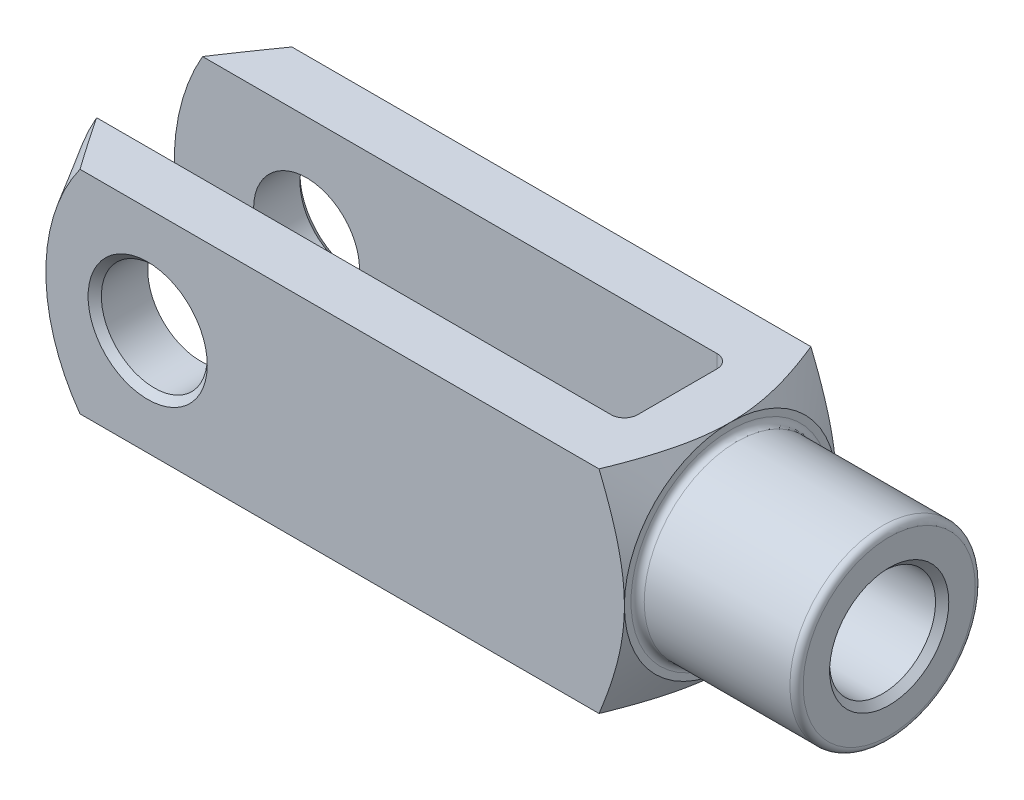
SolidWorks part; units mm, degrees
ref_plane "Front Plane" through (0, 0, 0) normal (0, 0, 1) x (1, 0, 0)
ref_plane "Top Plane" through (0, 0, 0) normal (0, 1, 0) x (1, 0, 0)
ref_plane "Right Plane" through (0, 0, 0) normal (1, 0, 0) x (0, 0, -1)
sketch "Sketch1" plane through (0, 0, 0) normal (1, 0, 0) x (0, 0, -1)
  line L0 (0, 0) -> (0, 50000) construction
  line L1 (0, 0) -> (50000, 0) construction
  line L2 (-8, -8) -> (-8, 8)
  line L3 (-8, 8) -> (8, 8)
  line L4 (8, -8) -> (8, 8)
  line L5 (-8, -8) -> (8, -8)
  point P9 (0, 8)
  point P11 (8, 0)
  point P12 (-8, 0)
  dimension "D1" = 16
  dimension "D2" = 16
extrude "Extrude1" add sketch "Sketch1" against normal blind 58
sketch "Sketch2" plane through (0, 0, 0) normal (1, 0, 0) x (0, 0, -1)
  circle A0 centre (0, 0) radius 7
  circle A1 centre (0, 0) radius 14
  dimension "D1" = 14
  dimension "D2" = 28
extrude "Extrude2" cut sketch "Sketch2" against normal blind 12
sketch "Sketch3" plane through (0, 0, 8) normal (0, 0, 1) x (1, 0, 0)
  circle A0 centre (-48, 0) radius 4
  dimension "D1" = 8
  dimension "D2" = 48
extrude "Extrude3" cut sketch "Sketch3" against normal through all
sketch "Sketch4" plane through (0, 8, 0) normal (0, 1, 0) x (1, 0, 0)
  line L0 (0, 0) -> (-50000, 0) construction
  line L1 (-58, -4) -> (-58, 4)
  line L2 (-58, 8) -> (-58, -8) construction
  line L3 (-58, 4) -> (-16, 4)
  line L4 (-16, 4) -> (-16, -4)
  line L5 (-48, 8) -> (-48, -8) construction
  line L6 (-58, -4) -> (-16, -4)
  point P7 (-48, 0)
  point P13 (-16, 0)
  point P14 (-58, 0)
  dimension "D1" = 32
  dimension "D2" = 8
extrude "Extrude4" cut sketch "Sketch4" against normal through all
fillet "Fillet1" radius 1 2 edges at (-16, 0, 4) (-16, 0, -4)
fillet "Fillet2" radius 0.5 2 edges at (0, 0, -7) (-12, 0, -7)
chamfer "Chamfer2" distance 0.5 angle 45 2 edges at (-44, 0, -8) (-44, 0, 8)
sketch "Sketch6" plane through (0, 0, 0) normal (0, 0, 1) x (1, 0, 0)
  line L0 (-12, -8) -> (-12, -16)
  line L1 (-12, -16) -> (-16.6188, -16)
  line L2 (-16.6188, -16) -> (-12, -8)
  dimension "D1" = 30
  dimension "D2" = 16
revolve "Cut-Revolve1" cut sketch "Sketch6" angle 360 about axis through (-12, 0, 0) along (1, 0, 0)
sketch "Sketch7" plane through (0, 0, 0) normal (0, 1, 0) x (1, 0, 0)
  line L0 (-55.6906, -8) -> (-58, -4)
  line L1 (-58, 4) -> (-55.6906, 8)
  line L2 (-55.6906, 8) -> (-74, 8)
  line L3 (-58, 4) -> (-58, -4)
  line L4 (-74, 8) -> (-74, -8)
  line L5 (-74, -8) -> (-55.6906, -8)
  line L6 (-58, 8) -> (-13.9132, 8) construction
  line L7 (-58, -8) -> (-13.9132, -8) construction
  line L8 (-42, 0.6162) -> (-42, 50000.6162) construction
  dimension "D1" = 120
  dimension "D2" = 16
  dimension "D3" = 16
revolve "Cut-Revolve2" cut sketch "Sketch7" angle 180 about L8
sketch "Sketch8" plane through (0, 0, 0) normal (1, 0, 0) x (0, 0, -1)
  circle A0 centre (0, 0) radius 4
  dimension "D1" = 8
extrude "Extrude5" cut sketch "Sketch8" against normal through all
chamfer "Chamfer3" distance 0.5 angle 45 1 edges at (0, 0, -4)
equation "\"D2@Sketch1\" = \"D1@Sketch1\""
equation "\"D2@Sketch2\" = \"D1@Sketch2\"*2"
equation "\"D2@Sketch6\" = \"D1@Sketch1\""
equation "\"D2@Sketch7\" = \"D1@Sketch1\""
equation "\"D3@Sketch7\" = \"D1@Sketch1\""
